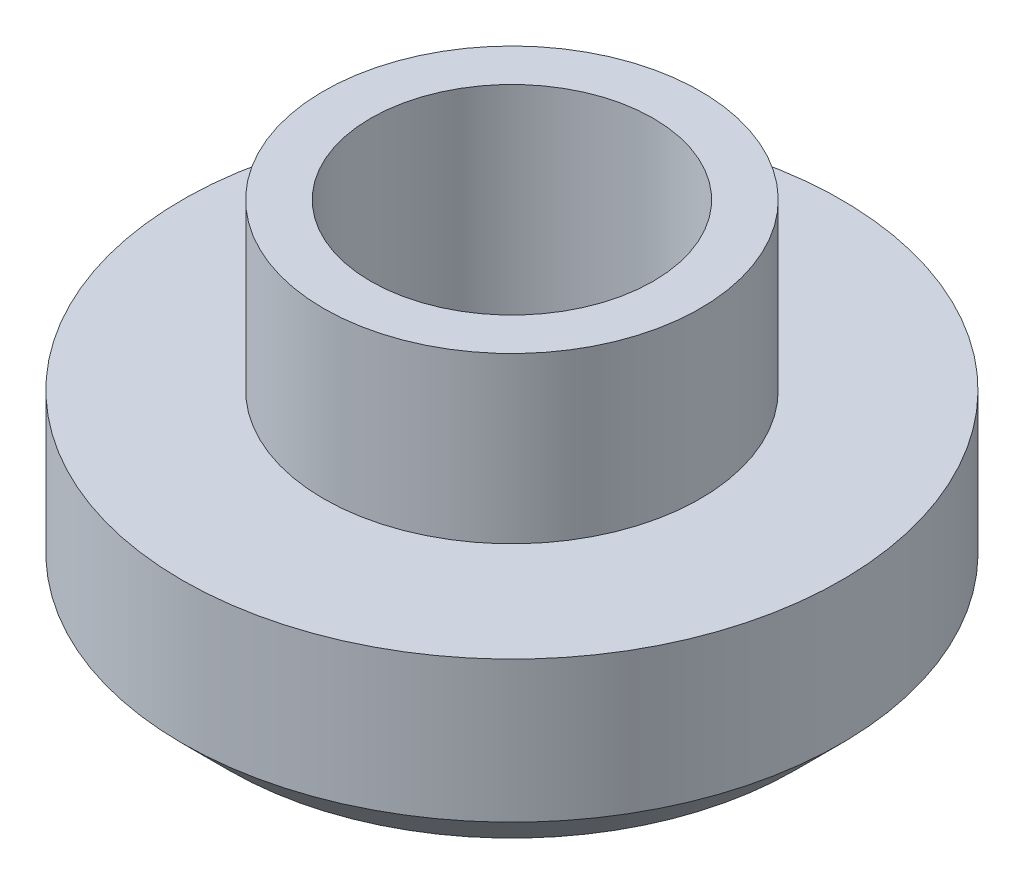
SolidWorks part; units mm, degrees
ref_plane "Front Plane" through (0, 0, 0) normal (0, 0, 1) x (1, 0, 0)
ref_plane "Top Plane" through (0, 0, 0) normal (0, 1, 0) x (1, 0, 0)
ref_plane "Right Plane" through (0, 0, 0) normal (1, 0, 0) x (0, 0, -1)
sketch "Sketch1" plane through (0, 0, 0) normal (0, 1, 0) x (1, 0, 0)
  circle A0 centre (0, 0) radius 7
  dimension "D1" = 14
extrude "Extrude1" add sketch "Sketch1" along normal blind 4
sketch "Sketch2" plane through (0, 4, 0) normal (0, 1, 0) x (1, 0, 0)
  circle A0 centre (0, 0) radius 4
  dimension "D1" = 8
extrude "Extrude2" add sketch "Sketch2" along normal blind 3.5
sketch "Sketch3" plane through (0, 7.5, 0) normal (0, 1, 0) x (1, 0, 0)
  circle A0 centre (0, 0) radius 3
  dimension "D1" = 6
extrude "Extrude3" cut sketch "Sketch3" against normal through all
chamfer "Chamfer1" distance 1 angle 45 1 edges at (0, 0, 7)
